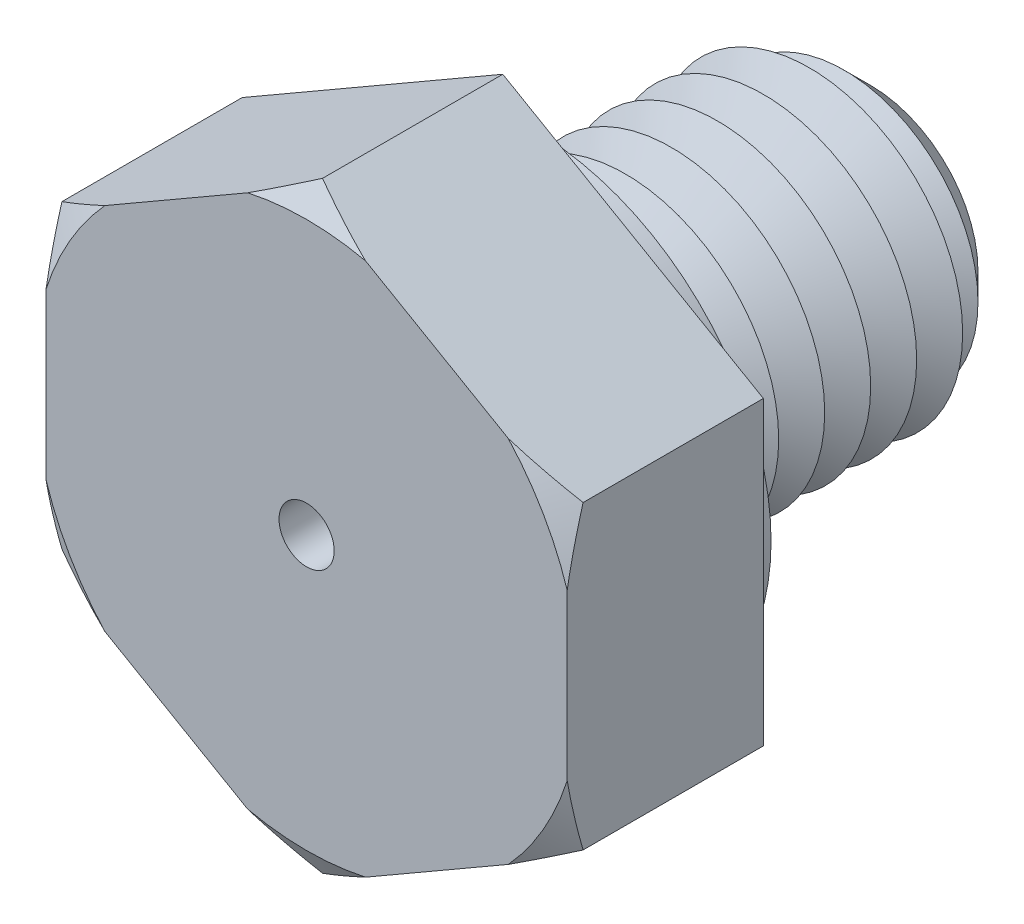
SolidWorks part; units mm, degrees
ref_plane "Front Plane" through (0, 0, 0) normal (0, 0, 1) x (1, 0, 0)
ref_plane "Top Plane" through (0, 0, 0) normal (0, 1, 0) x (1, 0, 0)
ref_plane "Right Plane" through (0, 0, 0) normal (1, 0, 0) x (0, 0, -1)
sketch "Sketch2" plane through (0, 0, 0) normal (0, 0, 1) x (1, 0, 0)
  line L1 (0, 9.815) -> (-8.5, 4.9075)
  line L2 (-8.5, 4.9075) -> (-8.5, -4.9075)
  line L3 (-8.5, -4.9075) -> (0, -9.815)
  line L4 (0, -9.815) -> (8.5, -4.9075)
  line L5 (8.5, -4.9075) -> (8.5, 4.9075)
  line L6 (8.5, 4.9075) -> (0, 9.815)
  circle A0 centre (0, 0) radius 8.5 construction
  dimension "D1" = 17
extrude "Boss-Extrude1" add sketch "Sketch2" along normal blind 6.4
sketch "Sketch3" plane through (0, 0, 0) normal (0, 0, -1) x (-1, 0, 0)
  circle A0 centre (0, 0) radius 5
  dimension "D1" = 10
extrude "Boss-Extrude2" add sketch "Sketch3" along normal blind 12
sketch "Sketch4" plane through (0, 0, 0) normal (0, 0, -1) x (-1, 0, 0)
  circle A0 centre (0, 0) radius 7.75
  dimension "D1" = 15.5
extrude "Boss-Extrude3" add sketch "Sketch4" along normal blind 1
sketch "Sketch5" plane through (0, 0, 0) normal (1, 0, 0) x (0, 0, -1)
  line L0 (-3.2117, 0) -> (6.3192, 0) construction
chamfer "Chamfer1" distance 1.5 angle 45 1 edges at (-5, 0, -12)
sketch "Sketch6" plane through (0, 0, 0) normal (1, 0, 0) x (0, 0, -1)
  line L0 (1, 5) -> (1.75, 3.701)
  line L1 (1.75, 3.701) -> (2.5, 5)
  line L2 (10.5, 5) -> (1, 5) construction
  line L3 (2.5, 5) -> (1, 5)
  dimension "D1" = 1.5
revolve "Cut-Revolve1" cut sketch "Sketch6" angle 360 about L0
pattern_linear "LPattern1" count 7 spacing 1.5 along (0, 0, -1) of "Cut-Revolve1"
sketch "Sketch7" plane through (0, 0, 0) normal (1, 0, 0) x (0, 0, -1)
  line L0 (-6.4, 9.815) -> (-6.4, 8.915)
  line L1 (-6.4, 4.9075) -> (-6.4, 9.815) construction
  line L2 (-6.4, 8.915) -> (-5.8804, 9.815)
  line L3 (-6.4, 9.815) -> (0, 9.815) construction
  line L4 (-5.8804, 9.815) -> (-6.4, 9.815)
  dimension "D1" = 0.9
  dimension "D2" = 30
revolve "Cut-Revolve2" cut sketch "Sketch7" angle 360 about L0
sketch "Sketch8" plane through (0, 0, 6.4) normal (0, 0, 1) x (1, 0, 0)
  circle A0 centre (0, 0) radius 0.9
  dimension "D1" = 1.8
extrude "Cut-Extrude1" cut sketch "Sketch8" against normal up to surface (18.4 mm away)
